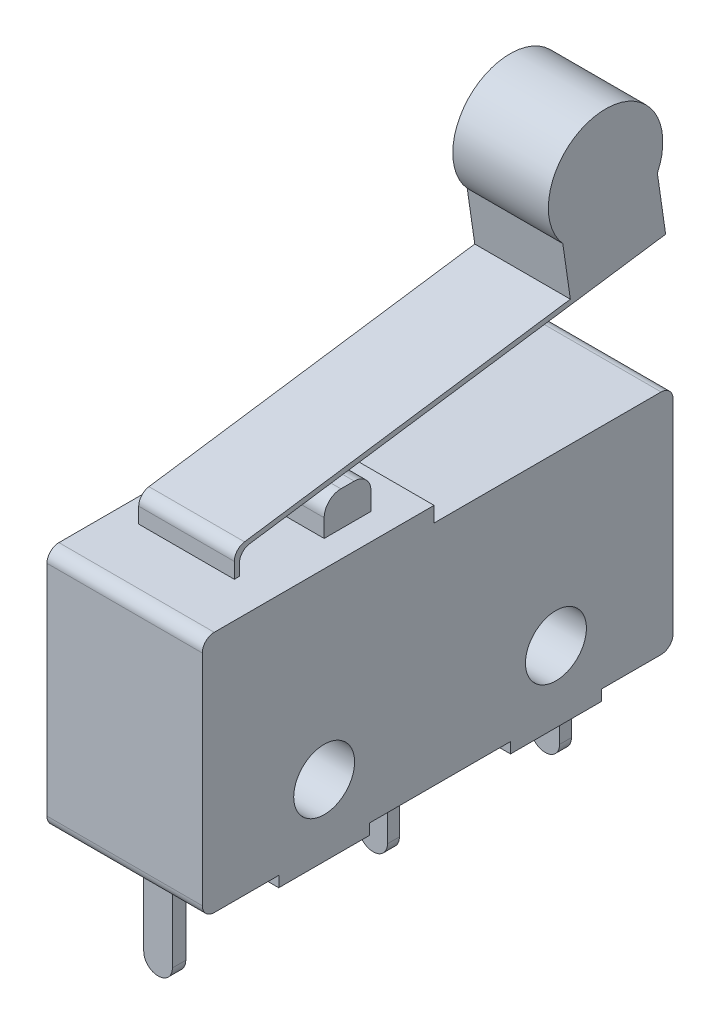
SolidWorks part; units mm, degrees
ref_plane "Front Plane" through (0, 0, 0) normal (0, 0, 1) x (1, 0, 0)
ref_plane "Top Plane" through (0, 0, 0) normal (0, 1, 0) x (1, 0, 0)
ref_plane "Right Plane" through (0, 0, 0) normal (1, 0, 0) x (0, 0, -1)
sketch "Sketch1" plane through (0, 0, 0) normal (1, 0, 0) x (0, 0, -1)
  line L0 (-37.3731, 0) -> (-34.6731, 0)
  line L1 (-37.8731, 0.5) -> (-37.8731, 9.66)
  line L2 (-37.3731, 10.16) -> (-28.1731, 10.16)
  line L3 (-28.1731, 10.16) -> (-28.1731, 9.52)
  line L4 (-28.1731, 9.52) -> (-18.6731, 9.52)
  line L5 (-18.1731, 9.02) -> (-18.1731, 0.5)
  line L6 (-34.6731, 0) -> (-34.6731, -0.45)
  line L7 (-34.6731, -0.45) -> (-30.8731, -0.45)
  line L8 (-30.8731, -0.45) -> (-30.8731, 0)
  line L9 (-30.8731, 0) -> (-24.9731, 0)
  line L10 (-24.9731, 0) -> (-24.9731, -0.45)
  line L11 (-24.9731, -0.45) -> (-21.1731, -0.45)
  line L12 (-21.1731, -0.45) -> (-21.1731, 0)
  line L13 (-21.1731, 0) -> (-18.6731, 0)
  line L14 (-32.7731, -0.45) -> (-32.7731, 2.9938) construction
  line L15 (-23.0731, -0.45) -> (-23.0731, 2.9938) construction
  arc A0 (-18.6731, 9.52) -> (-18.1731, 9.02) centre (-18.6731, 9.02) cw
  arc A1 (-18.6731, 0) -> (-18.1731, 0.5) centre (-18.6731, 0.5) ccw
  arc A2 (-37.3731, 0) -> (-37.8731, 0.5) centre (-37.3731, 0.5) cw
  arc A3 (-37.8731, 9.66) -> (-37.3731, 10.16) centre (-37.3731, 9.66) cw
  circle A4 centre (-32.7731, 2.525) radius 1.275
  circle A5 centre (-23.0731, 2.525) radius 1.275
  point P18 (-23.0731, -0.45)
  point P19 (-18.1731, 9.52)
  point P22 (-18.1731, 0)
  point P25 (-37.8731, 0)
  point P28 (-37.8731, 10.16)
  point P29 (-32.7731, -0.45)
  point P38 (-32.7731, 1.25)
  point P39 (-23.0731, 1.25)
  dimension "D11" = 0.5
  dimension "D12" = 2.55
  dimension "D13" = 2.55
  dimension "D1" = 9.52
  dimension "D2" = 10.16
  dimension "D3" = 3.8
  dimension "D4" = 3.8
  dimension "D5" = 0.45
  dimension "D6" = 0.45
  dimension "D7" = 19.7
  dimension "D8" = 3.2
  dimension "D9" = 9.7
  dimension "D10" = 5.9
  dimension "D14" = 1.7
  dimension "D15" = 1.7
extrude "Boss-Extrude1" add sketch "Sketch1" along normal blind 6.5
sketch "Sketch2" plane through (0, 10.16, 0) normal (0, 1, 0) x (1, 0, 0)
  line L0 (6.5, -28.1731) -> (6.5, -37.3731) construction
  line L1 (5.4, -31.6731) -> (1.87, -31.6731)
  line L2 (5.4, -31.6731) -> (5.4, -29.7131)
  line L3 (5.4, -29.7131) -> (1.87, -29.7131)
  line L4 (1.87, -31.6731) -> (1.87, -29.7131)
  line L5 (5.4, -31.6731) -> (1.87, -29.7131) construction
  line L6 (5.4, -29.7131) -> (1.87, -31.6731) construction
  line L7 (6.5, -37.8731) -> (0, -37.8731) construction
  point P0 (3.635, -30.6931)
  dimension "D1" = 1.96
  dimension "D2" = 3.53
  dimension "D3" = 1.1
  dimension "D4" = 6.2
extrude "Boss-Extrude2" add sketch "Sketch2" along normal blind 1.45
fillet "Fillet1" radius 0.7 2 edges at (3.635, 11.61, 29.7131) (3.635, 11.61, 31.6731)
sketch "Sketch3" plane through (0, 0, 0) normal (0, -1, 0) x (-1, 0, 0)
  line L0 (-3.25, -37.3731) -> (-3.25, -18.1731) construction
  line L1 (-6.5, -37.3731) -> (0, -37.3731) construction
  line L2 (-6.5, -18.1731) -> (0, -18.1731) construction
  line L3 (-6.5, -37.8731) -> (0, -37.8731) construction
  line L4 (-1.65, -36.4731) -> (-4.85, -36.4731)
  line L5 (-1.65, -36.4731) -> (-1.65, -35.9131)
  line L6 (-1.65, -35.9131) -> (-4.85, -35.9131)
  line L7 (-4.85, -36.4731) -> (-4.85, -35.9131)
  line L8 (-1.65, -36.4731) -> (-4.85, -35.9131) construction
  line L9 (-1.65, -35.9131) -> (-4.85, -36.4731) construction
  line L10 (-1.65, -26.9731) -> (-4.85, -26.9731)
  line L11 (-1.65, -26.9731) -> (-1.65, -27.4731)
  line L12 (-1.65, -27.4731) -> (-4.85, -27.4731)
  line L13 (-4.85, -26.9731) -> (-4.85, -27.4731)
  line L14 (-1.65, -26.9731) -> (-4.85, -27.4731) construction
  line L15 (-1.65, -27.4731) -> (-4.85, -26.9731) construction
  line L16 (-1.65, -19.7731) -> (-4.85, -19.7731)
  line L17 (-1.65, -19.7731) -> (-1.65, -20.2731)
  line L18 (-1.65, -20.2731) -> (-4.85, -20.2731)
  line L19 (-4.85, -19.7731) -> (-4.85, -20.2731)
  line L20 (-1.65, -19.7731) -> (-4.85, -20.2731) construction
  line L21 (-1.65, -20.2731) -> (-4.85, -19.7731) construction
  point P6 (-3.25, -36.1931)
  point P11 (-3.25, -27.2231)
  point P16 (-3.25, -20.0231)
  dimension "D1" = 3.2
  dimension "D2" = 0.56
  dimension "D3" = 3.2
  dimension "D4" = 0.5
  dimension "D5" = 3.2
  dimension "D6" = 0.5
  dimension "D7" = 1.6
  dimension "D8" = 1.4
  dimension "D9" = 6.7
extrude "Boss-Extrude3" add sketch "Sketch3" along normal blind 0.9
sketch "Sketch4" plane through (0, -0.9, 0) normal (0, -1, 0) x (-1, 0, 0)
  line L0 (-3.25, -36.4731) -> (-3.25, -19.7731) construction
  line L1 (-4.85, -36.4731) -> (-1.65, -36.4731) construction
  line L2 (-1.65, -19.7731) -> (-4.85, -19.7731) construction
  line L3 (-4.85, -36.4731) -> (-1.65, -36.4731) construction
  line L4 (-2.65, -36.4731) -> (-3.85, -36.4731)
  line L5 (-2.65, -36.4731) -> (-2.65, -35.9131)
  line L6 (-2.65, -35.9131) -> (-3.85, -35.9131)
  line L7 (-3.85, -36.4731) -> (-3.85, -35.9131)
  line L8 (-2.65, -36.4731) -> (-3.85, -35.9131) construction
  line L9 (-2.65, -35.9131) -> (-3.85, -36.4731) construction
  line L10 (-1.65, -35.9131) -> (-4.85, -35.9131) construction
  line L11 (-4.85, -27.4731) -> (-1.65, -27.4731) construction
  line L12 (-3.85, -26.9731) -> (-2.65, -26.9731)
  line L13 (-3.85, -26.9731) -> (-3.85, -27.4731)
  line L14 (-3.85, -27.4731) -> (-2.65, -27.4731)
  line L15 (-2.65, -26.9731) -> (-2.65, -27.4731)
  line L16 (-3.85, -26.9731) -> (-2.65, -27.4731) construction
  line L17 (-3.85, -27.4731) -> (-2.65, -26.9731) construction
  line L18 (-1.65, -26.9731) -> (-4.85, -26.9731) construction
  line L19 (-4.85, -20.2731) -> (-1.65, -20.2731) construction
  line L20 (-3.85, -19.7731) -> (-2.65, -19.7731)
  line L21 (-3.85, -19.7731) -> (-3.85, -20.2731)
  line L22 (-3.85, -20.2731) -> (-2.65, -20.2731)
  line L23 (-2.65, -19.7731) -> (-2.65, -20.2731)
  line L24 (-3.85, -19.7731) -> (-2.65, -20.2731) construction
  line L25 (-3.85, -20.2731) -> (-2.65, -19.7731) construction
  line L26 (-1.65, -19.7731) -> (-4.85, -19.7731) construction
  point P6 (-3.25, -36.1931)
  point P15 (-3.25, -27.2231)
  point P24 (-3.25, -20.0231)
  dimension "D1" = 1.2
  dimension "D2" = 1.2
  dimension "D3" = 1.2
extrude "Boss-Extrude4" add sketch "Sketch4" along normal blind 3.47
fillet "Fillet2" radius 0.59 6 edges at (2.65, -4.37, 36.1931) (3.85, -4.37, 36.1931) (2.65, -4.37, 27.2231) (3.85, -4.37, 27.2231) (3.85, -4.37, 20.0231) (2.65, -4.37, 20.0231)
sketch "Эскиз1" plane through (6.5, 0, 0) normal (1, 0, 0) x (0, 0, -1)
  line L0 (-34.8206, 10.16) -> (-34.8206, 11.0655)
  line L1 (-34.8206, 11.0655) -> (-16.9831, 13.64)
  line L2 (-16.9831, 13.64) -> (-17.5158, 17.3307)
  line L3 (-21.4746, 16.7581) -> (-20.9705, 13.2798)
  line L4 (-20.9705, 13.2798) -> (-35.0331, 11.2417)
  line L5 (-35.0331, 11.2417) -> (-35.0331, 10.16)
  line L6 (-28.1731, 10.16) -> (-37.3731, 10.16) construction
  line L7 (-35.0331, 10.16) -> (-34.8206, 10.16)
  line L8 (-37.8731, 9.66) -> (-37.8731, 0.5) construction
  line L9 (-18.1731, 0.5) -> (-18.1731, 9.02) construction
  line L10 (-19.4953, 19.44) -> (-23.4649, 19.44)
  arc A0 (-17.5158, 17.3307) -> (-21.4746, 16.7581) centre (-19.4953, 17.045) ccw
  circle A1 centre (-19.4953, 17.045) radius 2.395
  point P18 (0, 0)
  dimension "D1" = 2.84
  dimension "D2" = 4.79
  dimension "D3" = 2
  dimension "D4" = 1.19
extrude "Бобышка-Вытянуть1" add sketch "Эскиз1" against normal blind 4 from offset 1.5 contours A1 L3 L4 L5 L0 L1 L2 M5 | L3 A1 L2 A0 | A1 L3 A0 L2
fillet "Скругление1" radius 0.5 2 edges at (3, 11.0655, 34.8206) (3, 11.2417, 35.0331)
